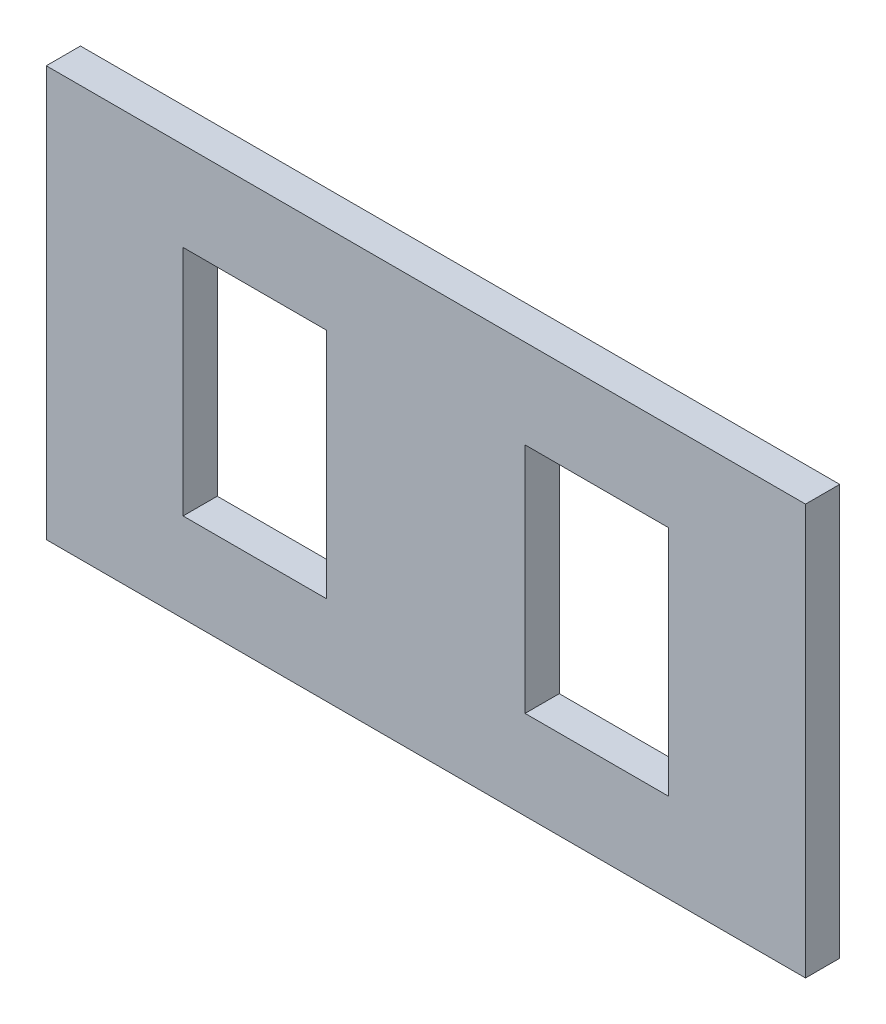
SolidWorks part; units mm, degrees
ref_plane "前基準面" through (0, 0, 0) normal (0, 0, 1) x (1, 0, 0)
ref_plane "上基準面" through (0, 0, 0) normal (0, 1, 0) x (1, 0, 0)
ref_plane "右基準面" through (0, 0, 0) normal (1, 0, 0) x (0, 0, -1)
sketch "草圖1" plane through (0, 0, 0) normal (0, 0, 1) x (1, 0, 0)
  line L0 (0, 0) -> (111, 0)
  line L1 (111, 0) -> (111, 60)
  line L2 (111, 60) -> (0, 60)
  line L3 (0, 60) -> (0, 0)
  line L4 (20, 47) -> (20, 13)
  line L5 (20, 13) -> (41, 13)
  line L6 (41, 13) -> (41, 47)
  line L7 (41, 47) -> (20, 47)
  line L8 (70, 13) -> (91, 13)
  line L9 (91, 47) -> (70, 47)
  line L10 (70, 47) -> (70, 13)
  line L11 (91, 13) -> (91, 47)
  point P13 (90.5904, 13)
  point P14 (112.4044, 0)
  dimension "D1" = 34
  dimension "D2" = 21
  dimension "D3" = 20
  dimension "D4" = 60
  dimension "D5" = 13
  dimension "D6" = 20
  dimension "D7" = 21
  dimension "D8" = 34
  dimension "D9" = 29
  dimension "D10" = 13
extrude "填料-伸長1" add sketch "草圖1" along normal blind 5
